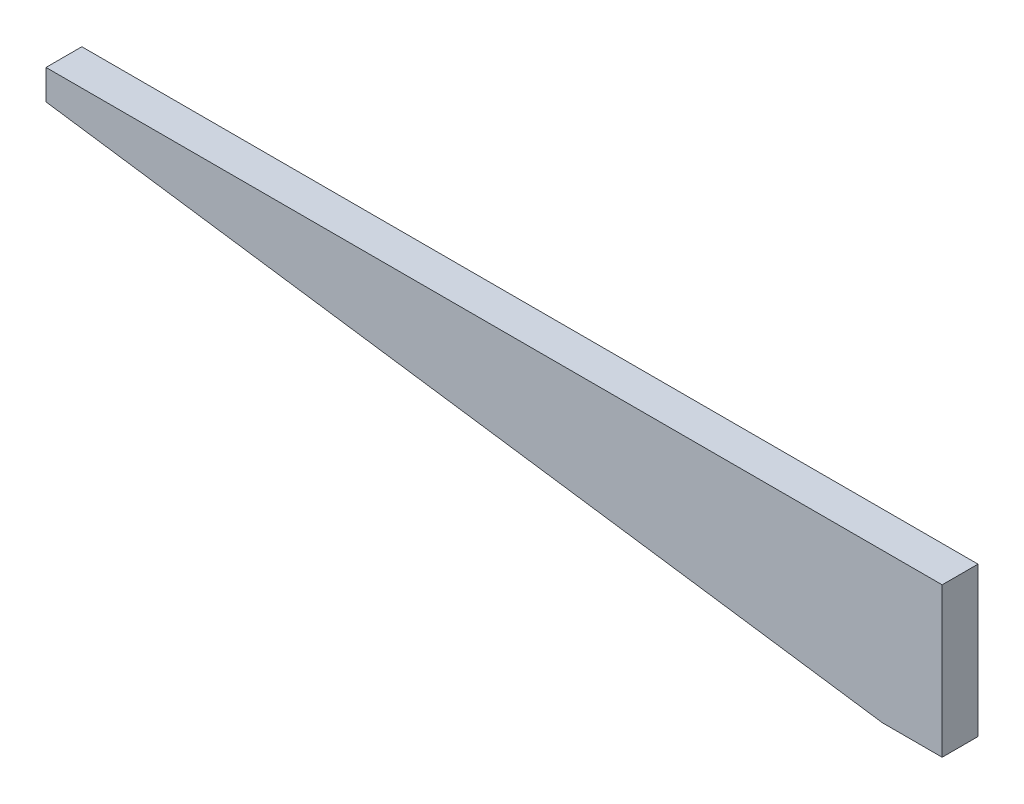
SolidWorks part; units mm, degrees
ref_plane "Face" through (0, 0, 0) normal (0, 0, 1) x (1, 0, 0)
ref_plane "Dessus" through (0, 0, 0) normal (0, 1, 0) x (1, 0, 0)
ref_plane "Droite" through (0, 0, 0) normal (1, 0, 0) x (0, 0, -1)
sketch "Esquisse1" plane through (0, 0, 0) normal (0, 0, 1) x (1, 0, 0)
  line L0 (0, 0) -> (0, 25)
  line L1 (0, 25) -> (-150, 25)
  line L2 (-150, 25) -> (-150, 20)
  line L3 (-150, 20) -> (-10, 0)
  line L4 (-10, 0) -> (0, 0)
  dimension "D1" = 25
  dimension "D2" = 150
  dimension "D3" = 5
  dimension "D4" = 10
extrude "Extrusion1" add sketch "Esquisse1" along normal mid plane 6
